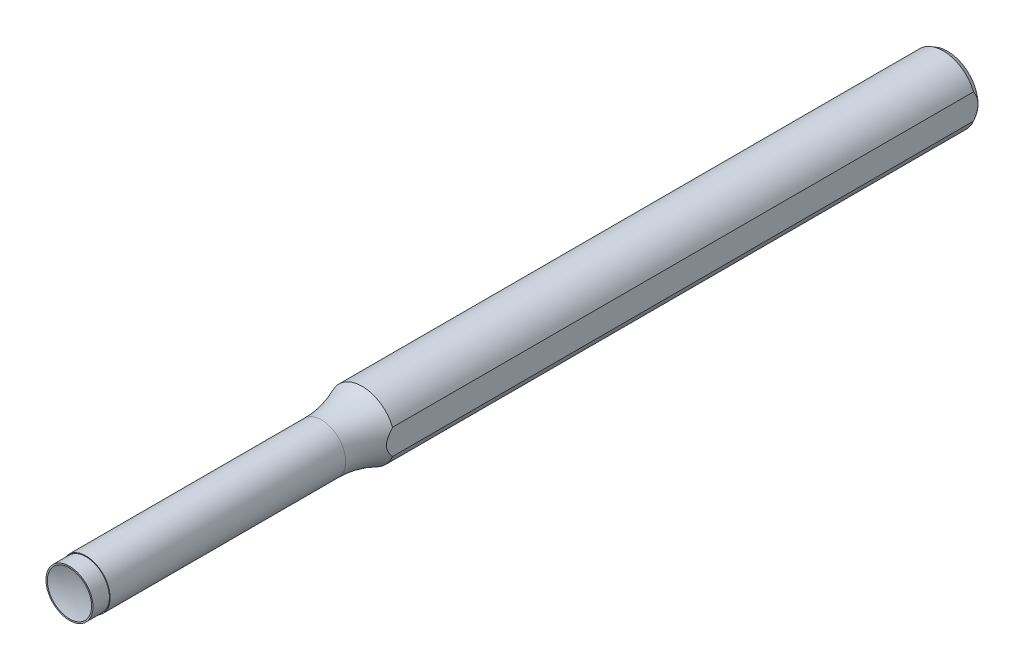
SolidWorks part; units mm, degrees
ref_plane "Front Plane" through (0, 0, 0) normal (0, 0, 1) x (1, 0, 0)
ref_plane "Top Plane" through (0, 0, 0) normal (0, 1, 0) x (1, 0, 0)
ref_plane "Right Plane" through (0, 0, 0) normal (1, 0, 0) x (0, 0, -1)
sketch "Sketch1" plane through (0, 0, 0) normal (0, 0, 1) x (1, 0, 0)
  circle A0 centre (0, 0) radius 4.765
  dimension "D1" = 9.53
extrude "Boss-Extrude1" add sketch "Sketch1" against normal blind 127
sketch "Sketch2" plane through (0, 0, 0) normal (0, 0, 1) x (1, 0, 0)
  circle A0 centre (0, 0) radius 3.5
  dimension "D1" = 7
extrude "Cut-Extrude1" cut sketch "Sketch2" against normal blind 42.3333 flip side to cut
sketch "Sketch3" plane through (0, 0, 0) normal (0, 0, 1) x (1, 0, 0)
  circle A0 centre (0, 0) radius 3.4
  dimension "D1" = 6.8
extrude "Cut-Extrude2" cut sketch "Sketch3" against normal blind 2.3825 flip side to cut
sketch "Sketch4" plane through (0, 0, 0) normal (1, 0, 0) x (0, 0, -1)
  line L0 (0, 0) -> (0, 3.2)
  line L1 (0, 3.4) -> (0, -3.4) construction
  line L2 (0.5533, 0) -> (0.5533, 3.2) construction
  line L3 (0, 0) -> (0.5533, 0)
  line L4 (0, 0) -> (0, -3.2) construction
  arc A0 (0.5533, 0) -> (0, 3.2) centre (-8.9767, 0) ccw
  dimension "D2" = 9.53
  dimension "D1" = 6.4
revolve "Cut-Revolve1" cut sketch "Sketch4" angle 360 about L3
chamfer "Chamfer1" distance 0.6353 angle 30 1 edges at (4.765, 0, -127)
sketch "Sketch5" plane through (0, 0, 0) normal (1, 0, 0) x (0, 0, -1)
  line L0 (42.3333, 0) -> (36.454, 0)
  line L1 (42.3333, 4.765) -> (42.3333, -4.765) construction
  line L2 (36.454, 0) -> (36.454, 3.5)
  line L3 (42.3333, 3.5) -> (2.3825, 3.5) construction
  line L4 (42.3333, 4.765) -> (42.3333, 0)
  line L5 (36.454, 3.5) -> (42.3333, 3.5) construction
  arc A0 (36.454, 3.5) -> (42.3333, 4.765) centre (36.454, 17.795) ccw
  dimension "D1" = 14.295
revolve "Revolve1" add sketch "Sketch5" angle 360 about L0
sketch "Sketch6" plane through (0, 0, 0) normal (1, 0, 0) x (0, 0, -1)
  line L0 (84.6667, 0) -> (98.9617, 0)
  line L1 (84.6667, 0) -> (84.6667, 9.53)
  line L2 (84.6667, 9.53) -> (90.7084, 9.53)
  line L3 (98.9617, 0) -> (98.9617, 4.765)
  line L4 (126.3647, 4.765) -> (42.3333, 4.765) construction
  line L5 (98.9617, 4.765) -> (84.6667, 4.765) construction
  line L6 (127, -4.765) -> (127, 4.765) construction
  arc A0 (98.9617, 4.765) -> (90.7084, 9.53) centre (98.9617, 14.295) cw
  dimension "D2" = 9.53
  dimension "D1" = 42.3333
  dimension "D3" = 14.295
revolve "Revolve2" [suppressed] add sketch "Sketch6" angle 360 about L0
sketch "Sketch7" plane through (0, 0, -127) normal (0, 0, -1) x (-1, 0, 0)
  line L9 (-8.0649, 1.8333) -> (-4.3982, 1.8333)
  line L10 (-8.0649, 1.8333) -> (-8.0649, -1.8333)
  line L11 (-8.0649, -1.8333) -> (-4.3982, -1.8333)
  line L12 (-4.3982, 1.8333) -> (-4.3982, -1.8333)
  circle A5 centre (0, 0) radius 4.765 construction
  circle A6 centre (0, 0) radius 4.3982 construction
  point P8 (-4.3982, 0)
extrude "Cut-Extrude3" cut sketch "Sketch7" against normal through all
